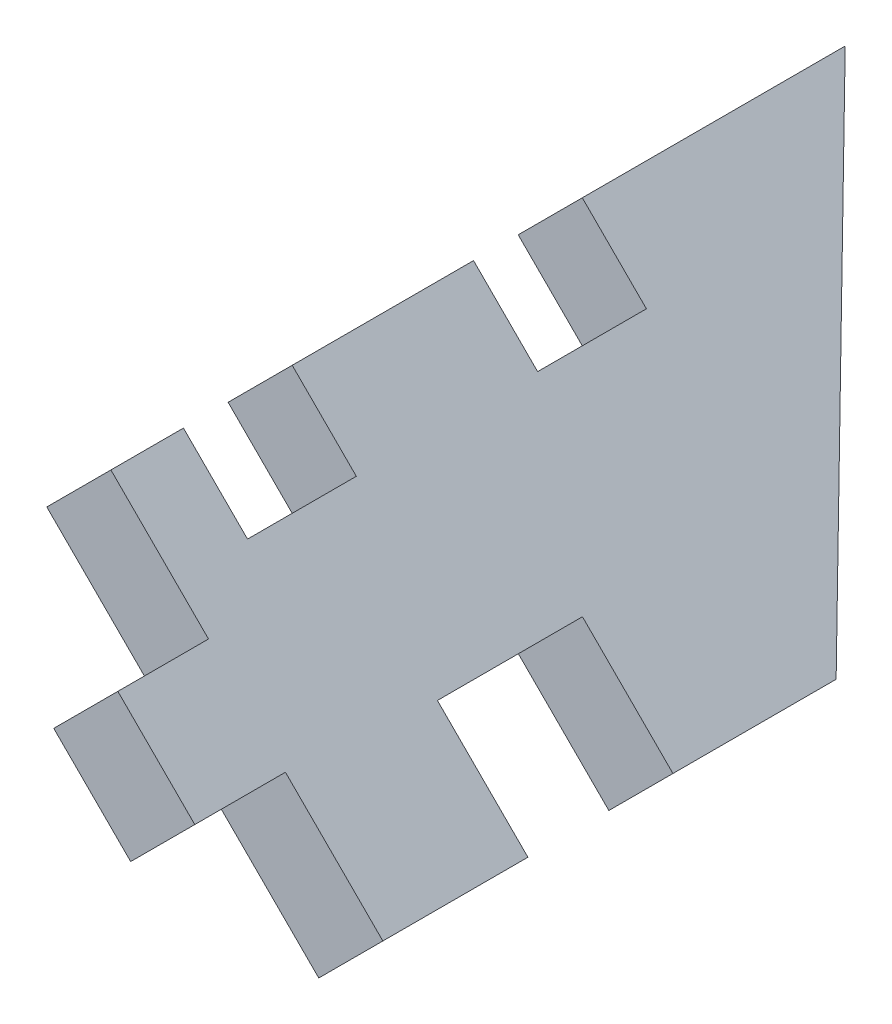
SolidWorks part; units mm, degrees
ref_plane "Front Plane" through (0, 0, 0) normal (0, 0, 1) x (1, 0, 0)
ref_plane "Top Plane" through (0, 0, 0) normal (0, 1, 0) x (1, 0, 0)
ref_plane "Right Plane" through (0, 0, 0) normal (1, 0, 0) x (0, 0, -1)
sketch "Sketch1" plane through (0, 0, 0) normal (0, 0, 1) x (1, 0, 0)
  line L0 (0, 0) -> (-38.1, 0) construction
  line L1 (-38.1, 0) -> (-38.1, 38.1) construction
  line L2 (-38.1, 38.1) -> (0, 0) construction
  dimension "D1" = 38.1
  dimension "D2" = 38.1
sketch "Sketch2" plane through (0, 0, 0) normal (1, 0, 0) x (0, 0, -1)
  line L0 (0, 0) -> (41.8141, 0) construction
ref_plane "Plane1" through (0, 0, 0) normal (0.7071, 0.7071, 0) x (0.7071, -0.7071, 0)
sketch "Sketch3" plane through (0, 0, 0) normal (0.7071, 0.7071, 0) x (0.7071, -0.7071, 0)
  line L0 (0, 0) -> (-26.9408, 0)
  line L1 (-26.9408, 0) -> (-26.9408, 51.435)
  line L2 (0, 0) -> (0, 31.75)
  line L3 (0, 0) -> (0, 41.8141) construction
  line L6 (-26.9408, 51.435) -> (0, 31.75)
  line L24 (-17.272, 0) -> (-9.652, 0)
  line L25 (-17.272, 0) -> (-17.272, -6.35)
  line L26 (-17.272, -6.35) -> (-9.652, -6.35)
  line L27 (-9.652, 0) -> (-9.652, -6.35)
  dimension "D1" = 26.9408
  dimension "D2" = 51.435
  dimension "D3" = 7.62
  dimension "D4" = 31.75
  dimension "D5" = 6.35
  dimension "D6" = 9.652
extrude "Boss-Extrude4" add sketch "Sketch3" along normal blind 6.35 contours L6 L1 L0 L2 | L27 L0 L25 L26
sketch "Sketch9" plane through (4.4901, 4.4901, 0) normal (0.7071, 0.7071, 0) x (0, 0, -1)
  line L0 (0, 26.9408) -> (51.435, 26.9408) construction
  line L1 (5.08, 26.9408) -> (12.7, 26.9408)
  line L2 (5.08, 26.9408) -> (5.08, 20.5908)
  line L3 (5.08, 20.5908) -> (12.7, 20.5908)
  line L4 (12.7, 26.9408) -> (12.7, 20.5908)
  line L5 (0, 17.272) -> (0, 26.9408) construction
  line L6 (25.4, 26.9408) -> (33.02, 26.9408)
  line L7 (25.4, 26.9408) -> (25.4, 20.5908)
  line L8 (25.4, 20.5908) -> (33.02, 20.5908)
  line L9 (33.02, 26.9408) -> (33.02, 20.5908)
  line L10 (0, 0) -> (31.75, 0) construction
  line L11 (10.16, 0) -> (20.32, 0)
  line L12 (10.16, 0) -> (10.16, 8.9662)
  line L13 (10.16, 8.9662) -> (20.32, 8.9662)
  line L14 (20.32, 0) -> (20.32, 8.9662)
  line L15 (0, 0) -> (0, 9.652) construction
  dimension "D1" = 6.35
  dimension "D2" = 6.35
  dimension "D3" = 5.08
  dimension "D4" = 12.7
  dimension "D5" = 7.62
  dimension "D6" = 7.62
  dimension "D7" = 8.9662
  dimension "D8" = 10.16
  dimension "D9" = 10.16
extrude "Cut-Extrude2" cut sketch "Sketch9" against normal blind 101.6
